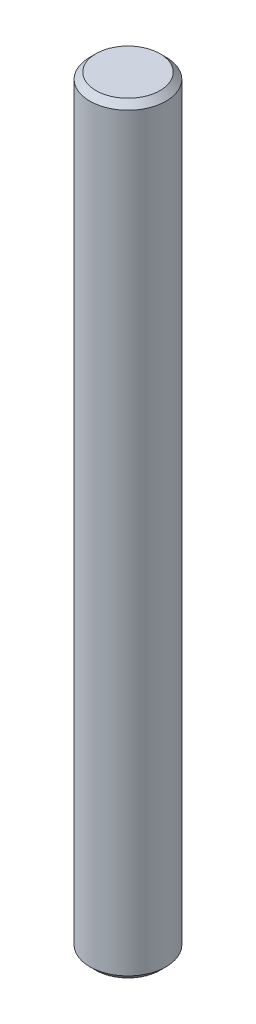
SolidWorks part; units mm, degrees
ref_plane "Front" through (0, 0, 0) normal (0, 0, 1) x (1, 0, 0)
ref_plane "Top" through (0, 0, 0) normal (0, 1, 0) x (1, 0, 0)
ref_plane "Right" through (0, 0, 0) normal (1, 0, 0) x (0, 0, -1)
sketch "Sketch2" plane through (0, 0, 0) normal (0, 1, 0) x (0, 0, -1)
  circle A0 centre (0, 0) radius 12.5
  dimension "D1" = 25
extrude "Boss-Extrude1" add sketch "Sketch2" along normal mid plane 250
chamfer "Chamfer1" distance 2 angle 45 2 edges at (0, -125, 12.5) (0, 125, 12.5)
